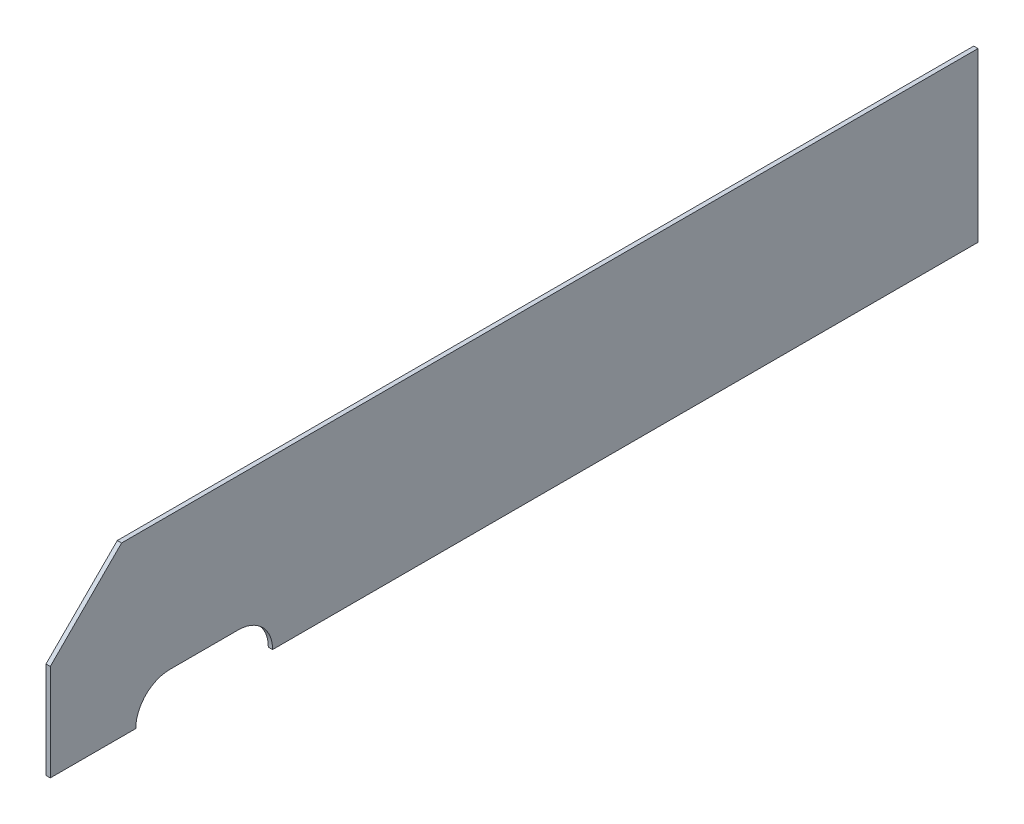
SolidWorks part; units mm, degrees
ref_plane "Front Plane" through (0, 0, 0) normal (0, 0, 1) x (1, 0, 0)
ref_plane "Top Plane" through (0, 0, 0) normal (0, 1, 0) x (1, 0, 0)
ref_plane "Right Plane" through (0, 0, 0) normal (1, 0, 0) x (0, 0, -1)
sketch "Sketch1" plane through (-912.2029, 0, 0) normal (-1, 0, 0) x (0, 0, 1)
  line L0 (1338.6392, 402.2121) -> (1391.5908, 349.2605)
  line L1 (1391.5908, 349.2605) -> (1391.5908, 277.5506)
  line L2 (1391.5908, 277.5506) -> (702.6158, 277.5506)
  line L3 (702.6158, 277.5506) -> (702.6158, 402.2121)
  line L4 (702.6158, 402.2121) -> (1338.6392, 402.2121)
extrude "Boss-Extrude1" add sketch "Sketch1" against normal blind 3.175
sketch "Sketch2" plane through (-912.2029, 0, 0) normal (-1, 0, 0) x (0, 0, 1)
  line L0 (1251.8908, 277.5506) -> (1302.6908, 277.5506) construction
  line L1 (702.6158, 277.5506) -> (1391.5908, 277.5506) construction
  line L2 (1251.8908, 302.9506) -> (1302.6908, 302.9506)
  line L3 (1251.8908, 252.1506) -> (1302.6908, 252.1506)
  line L4 (1391.5908, 277.5506) -> (1391.5908, 349.2605) construction
  arc A0 (1251.8908, 302.9506) -> (1251.8908, 252.1506) centre (1251.8908, 277.5506) ccw
  arc A1 (1302.6908, 252.1506) -> (1302.6908, 302.9506) centre (1302.6908, 277.5506) ccw
  point P4 (1277.2908, 277.5506)
  dimension "D1" = 25.4
  dimension "D2" = 88.9
  dimension "D3" = 50.8
extrude "Cut-Extrude1" cut sketch "Sketch2" against normal through all
